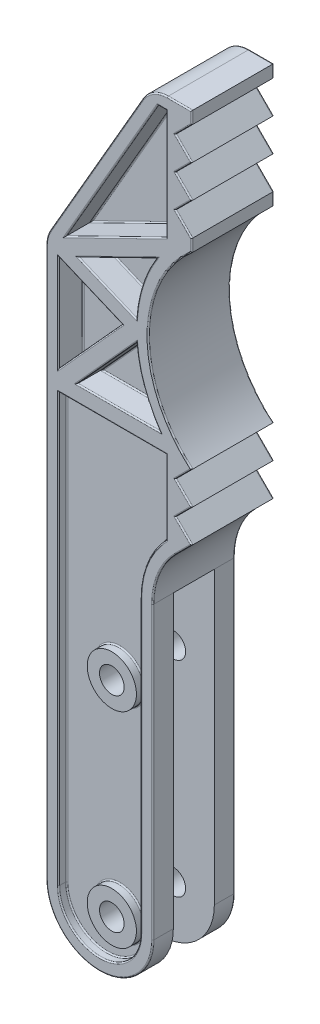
SolidWorks part; units mm, degrees
ref_plane "Front Plane" through (0, 0, 0) normal (0, 0, 1) x (1, 0, 0)
ref_plane "Top Plane" through (0, 0, 0) normal (0, 1, 0) x (1, 0, 0)
ref_plane "Right Plane" through (0, 0, 0) normal (1, 0, 0) x (0, 0, -1)
sketch "Sketch1" plane through (0, 0, 0) normal (0, 0, 1) x (1, 0, 0)
  line L0 (0, 0) -> (0, 90) construction
  line L1 (0, 90) -> (-5, 90) construction
  line L2 (-5, 90) -> (-17.75, 67.9164) construction
  line L3 (-17.75, 67.9164) -> (-17.75, 0) construction
  line L4 (-17.75, 0) -> (0, 0) construction
  line L5 (-2, 90) -> (-2, 75) construction
  line L6 (-2, 75) -> (0, 75) construction
  line L7 (0, 88.5) -> (-2, 86.5)
  line L8 (-2, 86.5) -> (0, 84.5)
  line L9 (0, 84.5) -> (-2, 82.5)
  line L10 (-2, 82.5) -> (0, 80.5)
  line L11 (0, 80.5) -> (-2, 78.5)
  line L12 (-2, 78.5) -> (0, 76.5)
  line L13 (-17.75, 64.3) -> (0, 64.3) construction
  line L14 (-9.75, 0) -> (-9.75, 25) construction
  line L15 (-2, 42.1) -> (0, 44.1)
  line L16 (0, 44.1) -> (-2, 46.1)
  line L17 (-2, 46.1) -> (0, 48.1)
  line L18 (0, 48.1) -> (-2, 50.1)
  line L19 (-2, 50.1) -> (0, 52.1)
  line L20 (0, 88.5) -> (0, 90)
  line L21 (0, 90) -> (-5, 90)
  line L22 (0, 76.5) -> (0, 75)
  line L23 (-5, 90) -> (-17.75, 67.9164)
  line L24 (-17.75, 67.9164) -> (-17.75, 0)
  line L25 (-4.75, 0) -> (-4.75, 35.4609)
  arc A0 (0, 75) -> (0, 52.1) centre (9.6901, 63.55) ccw
  arc A1 (-17.75, 0) -> (-4.75, 0) centre (-11.25, 0) ccw
  arc A2 (-2, 42.1) -> (-4.75, 35.4609) centre (4.6391, 35.4609) ccw
  circle A3 centre (-9.75, 0) radius 1.5
  circle A4 centre (-9.75, 25) radius 1.5
  dimension "D11" = 15
  dimension "D12" = 6.5
  dimension "D13" = 3
  dimension "D1" = 90
  dimension "D2" = 30
  dimension "D3" = 5
  dimension "D4" = 17.75
  dimension "D5" = 2
  dimension "D6" = 15
  dimension "D7" = 1.5
  dimension "D8" = 3.5
  dimension "D10" = 24.2
  dimension "D14" = 5
  dimension "D15" = 25
  dimension "D9" = 3
extrude "Boss-Extrude1" add sketch "Sketch1" along normal mid plane 10
sketch "Sketch2" plane through (0, 0, 0) normal (0, 0, 1) x (1, 0, 0)
  line L0 (-15, -8.4108) -> (-15, 23.5892)
  line L1 (-4.75, 0) -> (-4.75, 35.4609) construction
  line L2 (-4.75, 0) -> (-4.75, -8.4108)
  line L3 (-4.75, -8.4108) -> (-15, -8.4108)
  line L4 (-4.75, 0) -> (-4.75, 35.4609)
  arc A0 (-15, 23.5892) -> (-4.75, 35.4609) centre (-3, 23.5892) cw
  dimension "D2" = 12
  dimension "D1" = 10.25
  dimension "D3" = 32
extrude "Cut-Extrude1" cut sketch "Sketch2" against normal mid plane 5
sketch "Sketch3" plane through (0, 0, 5) normal (0, 0, 1) x (1, 0, 0)
  line L0 (-3.1276, 88.5) -> (-3.1276, 43.0931)
  line L34 (-2.1213, 88.5) -> (-4.134, 88.5)
  line L35 (-4.134, 88.5) -> (-16.25, 67.5144)
  line L36 (-16.25, 67.5144) -> (-16.25, 0)
  line L37 (-6.25, 0) -> (-6.25, 35.4609)
  line L38 (-3.0607, 43.1607) -> (-2.1213, 44.1)
  line L39 (-2.1213, 44.1) -> (-4.1213, 46.1)
  line L40 (-4.1213, 46.1) -> (-2.1213, 48.1)
  line L41 (-2.1213, 48.1) -> (-4.1213, 50.1)
  line L42 (-4.1213, 50.1) -> (-2.1565, 52.0648)
  line L43 (-1.5, 75.6757) -> (-1.5, 75.8787)
  line L44 (-1.5, 75.8787) -> (-4.1213, 78.5)
  line L45 (-4.1213, 78.5) -> (-2.1213, 80.5)
  line L46 (-2.1213, 80.5) -> (-4.1213, 82.5)
  line L47 (-4.1213, 82.5) -> (-2.1213, 84.5)
  line L48 (-2.1213, 84.5) -> (-4.1213, 86.5)
  line L49 (-4.1213, 86.5) -> (-2.1213, 88.5)
  line L50 (-2.1213, 88.5) -> (-4.134, 88.5)
  line L51 (-4.134, 88.5) -> (-16.25, 67.5144)
  line L52 (-16.25, 67.5144) -> (-16.25, 0)
  line L53 (-6.25, 0) -> (-6.25, 35.4609)
  line L54 (-3.0607, 43.1607) -> (-2.1213, 44.1) construction
  line L55 (-2.1213, 44.1) -> (-4.1213, 46.1) construction
  line L56 (-4.1213, 46.1) -> (-2.1213, 48.1) construction
  line L57 (-2.1213, 48.1) -> (-4.1213, 50.1) construction
  line L58 (-4.1213, 50.1) -> (-2.1565, 52.0648) construction
  line L59 (-1.5, 75.6757) -> (-1.5, 75.8787) construction
  line L60 (-1.5, 75.8787) -> (-4.1213, 78.5) construction
  line L61 (-4.1213, 78.5) -> (-2.1213, 80.5) construction
  line L62 (-2.1213, 80.5) -> (-4.1213, 82.5) construction
  line L63 (-4.1213, 82.5) -> (-2.1213, 84.5) construction
  line L64 (-2.1213, 84.5) -> (-4.1213, 86.5) construction
  line L65 (-4.1213, 86.5) -> (-2.1213, 88.5) construction
  arc A6 (-16.25, 0) -> (-6.25, 0) centre (-11.25, 0) ccw
  arc A7 (-3.0607, 43.1607) -> (-6.25, 35.4609) centre (4.6391, 35.4609) ccw
  arc A8 (-1.5, 75.6757) -> (-2.1565, 52.0648) centre (9.6901, 63.55) ccw
  arc A9 (-16.25, 0) -> (-6.25, 0) centre (-11.25, 0) ccw
  arc A10 (-3.0607, 43.1607) -> (-6.25, 35.4609) centre (4.6391, 35.4609) ccw
  arc A11 (-1.5, 75.6757) -> (-2.1565, 52.0648) centre (9.6901, 63.55) ccw
  dimension "D1" = 1.5
extrude "Cut-Extrude2" cut sketch "Sketch3" against normal blind 1 contours A11 L0 L50 L51 L52 A9 L53 A10 M41 M20
sketch "Sketch4" plane through (0, 0, 4) normal (0, 0, 1) x (1, 0, 0)
  circle A0 centre (-9.75, 25) radius 1.5 construction
  circle A1 centre (-9.75, 25) radius 1.5
  circle A2 centre (-9.75, 0) radius 1.5 construction
  circle A3 centre (-9.75, 0) radius 1.5
extrude "Extrude-Thin1" add sketch "Sketch4" along normal blind 1 thin
sketch "Sketch5" plane through (0, 0, 4) normal (0, 0, 1) x (1, 0, 0)
  line L6 (-3.1276, 53.1598) -> (-16.25, 53.1598)
  line L12 (-3.1276, 73.9402) -> (-3.1276, 88.5)
  line L13 (-3.1276, 88.5) -> (-4.134, 88.5)
  line L14 (-4.134, 88.5) -> (-16.25, 67.5144)
  line L15 (-16.25, 67.5144) -> (-16.25, 0)
  line L16 (-6.25, 0) -> (-6.25, 35.4609)
  line L17 (-3.1276, 43.0931) -> (-3.1276, 53.1598)
  line L18 (-3.1276, 73.9402) -> (-3.1276, 88.5)
  line L19 (-3.1276, 88.5) -> (-4.134, 88.5)
  line L20 (-4.134, 88.5) -> (-16.25, 67.5144)
  line L21 (-16.25, 67.5144) -> (-16.25, 0)
  line L22 (-6.25, 0) -> (-6.25, 35.4609) construction
  line L23 (-3.1276, 43.0931) -> (-3.1276, 53.1598) construction
  arc A6 (-3.1276, 73.9402) -> (-3.1276, 53.1598) centre (9.6901, 63.55) ccw
  arc A7 (-16.25, 0) -> (-6.25, 0) centre (-11.25, 0) ccw
  arc A8 (-3.1276, 43.0931) -> (-6.25, 35.4609) centre (4.6391, 35.4609) ccw
  arc A9 (-3.1276, 73.9402) -> (-3.1276, 53.1598) centre (9.6901, 63.55) ccw
  arc A10 (-16.25, 0) -> (-6.25, 0) centre (-11.25, 0) ccw construction
  arc A11 (-3.1276, 43.0931) -> (-6.25, 35.4609) centre (4.6391, 35.4609) ccw construction
  dimension "D1" = 0
extrude "Cut-Extrude3" cut sketch "Sketch5" against normal blind 2 contours L6 M11 M12 M13 M14 M15
sketch "Sketch7" plane through (0, 0, 5) normal (0, 0, 1) x (1, 0, 0)
  line L0 (-16.25, 53.1598) -> (-3.1276, 53.1598)
  line L1 (-16.25, 53.1598) -> (-6.8099, 63.55)
  line L2 (-6.8099, 63.55) -> (-16.25, 67.5144)
  line L3 (-16.25, 67.5144) -> (-3.1276, 73.9402)
  arc A0 (-3.1276, 73.9402) -> (-3.1276, 53.1598) centre (9.6901, 63.55) ccw construction
extrude "Extrude-Thin3" add sketch "Sketch7" against normal up to body thin
sketch "Sketch8" plane through (0, 0, 5) normal (0, 0, 1) x (1, 0, 0)
  line L0 (-3.5674, 74.8383) -> (-3.1276, 73.9402) construction
  line L1 (-3.5674, 74.8383) -> (-3.1276, 73.9402)
  line L2 (-3.5674, 74.8383) -> (-3.1276, 75.0536)
  line L3 (-15.3538, 69.0668) -> (-3.5674, 74.8383) construction
  line L4 (-3.1276, 88.5) -> (-3.1276, 73.9402) construction
  line L5 (-3.1276, 75.0536) -> (-3.1276, 73.9402)
  point P8 (0, 0)
extrude "Boss-Extrude2" add sketch "Sketch8" against normal up to surface (3 mm away)
mirror "Mirror2" about plane through (0, 0, 0) normal (0, 0, 1) of "Extrude-Thin3", "Boss-Extrude2", "Cut-Extrude3", "Extrude-Thin1", "Cut-Extrude2"
fillet "Fillet1" radius 3.5 2 edges at (-5, 90, 0) (-17.75, 67.9164, 0)
fillet "Fillet2" radius 0.15 124 edges at (-6.75, 25, 4) (-6.75, 0, 4) (-11.25, -6.5, 5) (-9.7439, 78.7834, 2) (-3.6308, 88.5, 2) (-5.8333, 57.9576, 2) (-6.0258, 68.576, 2) (-16.25, 60.5384, 2) (-4.75, 17.7305, 5) (-16.25, 60.5384, 5) (-16.25, 26.0799, 5) (-16.25, 26.0799, 4) (-3.1276, 47.6264, 5) (-3.1276, 47.6264, 4) (-6.0258, 68.576, 5) (-5.8333, 57.9576, 5) (-9.0871, 69.9085, 2) (-10.3044, 66.1021, 2) (-10.3695, 58.145, 2) (-8.9338, 54.1598, 2) (-9.6888, 52.1598, 4) (0, 89.25, -5) (-9.6888, 52.1598, 5) (-12.3756, 58.9113, 2) (-12.3756, 58.9113, 5) (-12.3756, 64.8027, 2) (-12.3756, 64.8027, 5) (-9.2407, 72.0602, 5) (-9.2407, 72.0602, 2) (-8.9338, 54.1598, 5) (-10.3695, 58.145, 5) (-10.3044, 66.1021, 5) (-9.0871, 69.9085, 5) (-1, 87.5, -5) (-1, 85.5, -5) (-1, 83.5, -5) (-1, 81.5, -5) (-4.0353, 39.054, 5) (-1, 79.5, -5) (-1, 77.5, -5) (0, 75.75, -5) (-5.3099, 63.55, -5) (-3.1276, 81.7768, 2) (-1, 51.1, -5) (-1, 49.1, -5) (-1, 47.1, -5) (-1, 43.1, 5) (-1, 45.1, -5) (-3.6308, 88.5, -5) (-9.7439, 78.7834, -5) (-11.25, -5, -5) (-1, 43.1, -5) (-6.25, 17.7305, -5) (-5.4392, 39.584, -4) (-11.25, -5, -4) (-6.25, 17.7305, -4) (-4.0353, 39.054, -5) (-5.4392, 39.584, -5) (-3.1276, 81.7768, -5) (-4.75, 17.7305, -5) (-11.25, -6.5, -5) (-12.75, 25, -4) (-1.4896, 90, -5) (-1, 45.1, 5) (-12.75, 0, -4) (-3.6308, 88.5, -2) (-9.7439, 78.7834, -2) (-16.25, 60.5384, -2) (-1, 47.1, 5) (-5.8333, 57.9576, -2) (-6.0258, 68.576, -2) (-3.1276, 47.6264, -4) (-16.25, 26.0799, -4) (-3.1276, 47.6264, -5) (-16.25, 60.5384, -5) (-16.25, 26.0799, -5) (-6.0258, 68.576, -5) (-5.8333, 57.9576, -5) (-9.2407, 72.0602, -2) (-12.3756, 64.8027, -2) (-12.3756, 58.9113, -2) (-9.6888, 52.1598, -4) (-8.9338, 54.1598, -2) (-8.9338, 54.1598, -5) (-10.3695, 58.145, -2) (-10.3695, 58.145, -5) (-10.3044, 66.1021, -2) (-10.3044, 66.1021, -5) (-9.0871, 69.9085, -2) (-9.0871, 69.9085, -5) (-9.6888, 52.1598, -5) (-12.3756, 58.9113, -5) (-12.3756, 64.8027, -5) (-9.2407, 72.0602, -5) (-1, 49.1, 5) (-3.1276, 81.7768, -2) (-1, 51.1, 5) (-11.6457, 78.4893, -5) (-11.6457, 78.4893, 5) (-17.75, 33.4893, -5) (-17.6307, 67.8844, -5) (-4.7293, 89.5311, -5) (-17.75, 33.4893, 5) (-17.6307, 67.8844, 5) (-4.7293, 89.5311, 5) (-5.3099, 63.55, 5) (-1.4896, 90, 5) (0, 75.75, 5) (-1, 77.5, 5) (-1, 79.5, 5) (-1, 81.5, 5) (-1, 83.5, 5) (-1, 85.5, 5) (-1, 87.5, 5) (0, 89.25, 5) (-5.4392, 39.584, 5) (-6.25, 17.7305, 4) (-11.25, -5, 4) (-3.1276, 81.7768, 5) (-5.4392, 39.584, 4) (-3.6308, 88.5, 5) (-9.7439, 78.7834, 5) (-11.25, -5, 5) (-6.25, 17.7305, 5)
